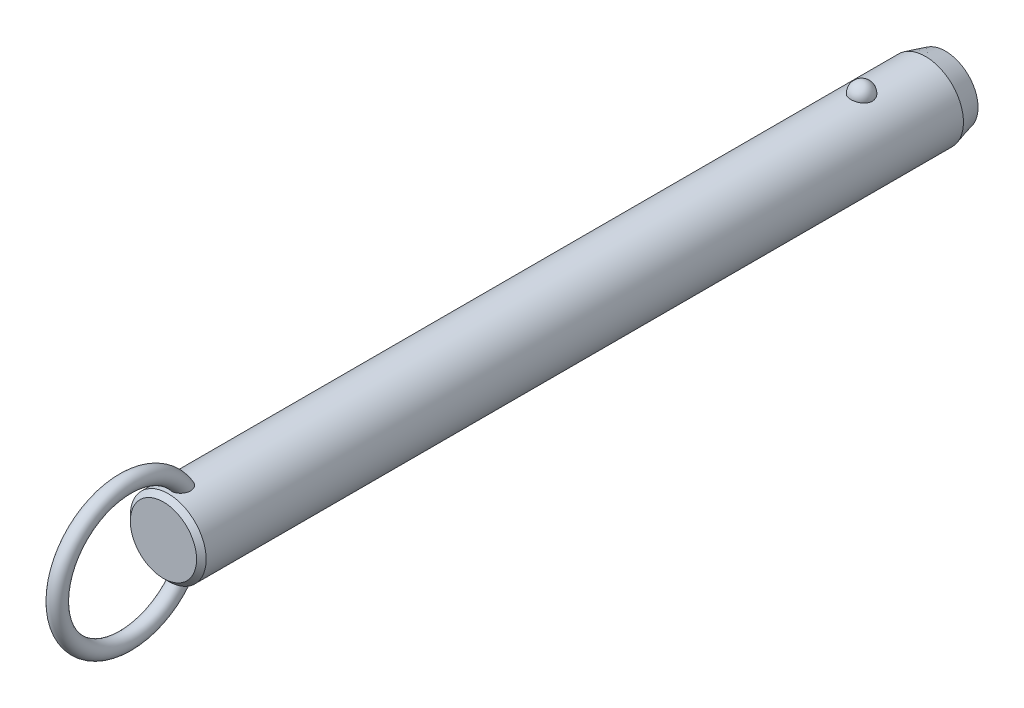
SolidWorks part; units mm, degrees
ref_plane "Front Plane" through (0, 0, 0) normal (0, 0, 1) x (1, 0, 0)
ref_plane "Top Plane" through (0, 0, 0) normal (0, 1, 0) x (1, 0, 0)
ref_plane "Right Plane" through (0, 0, 0) normal (1, 0, 0) x (0, 0, -1)
sketch "Sketch2" plane through (0, 0, 0) normal (0, 0, 1) x (1, 0, 0)
  circle A0 centre (0, 0) radius 9.5
  point P3 (0, 9.5)
  dimension "D1" = 19
extrude "Boss-Extrude1" add sketch "Sketch2" along normal blind 162.6
sketch "Sketch3" plane through (0, 0, 0) normal (0, 0, -1) x (-1, 0, 0)
  circle A0 centre (0, 0) radius 9.5
  dimension "D1" = 19
extrude "Boss-Extrude2" add sketch "Sketch3" along normal blind 23.7
chamfer "Chamfer1" distance 5 angle 15 1 edges at (-9.5, 0, -23.7)
sketch "Sketch12" plane through (0, 0, 0) normal (1, 0, 0) x (0, 0, -1)
  line L0 (-162.6, 9.5) -> (-162.6, -9.5) construction
  point P0 (-162.6, 0)
sketch "Sketch13" plane through (0, 0, 0) normal (1, 0, 0) x (0, 0, -1)
  circle A0 centre (-181.65, 0) radius 19.05
  point P2 (-162.6, 0)
  dimension "D1" = 38.1
sketch "Sketch14" plane through (0, 0, 0) normal (0, 1, 0) x (1, 0, 0)
  circle A0 centre (0, -164.6) radius 2
  point P2 (0, -162.6)
  dimension "D1" = 4
sweep "Sweep1" add profiles "Sketch14" path "Sketch13"
sketch "Sketch15" plane through (0, 0, 162.6) normal (0, 0, 1) x (1, 0, 0)
  circle A0 centre (0, 0) radius 9.5
  dimension "D1" = 19
extrude "Boss-Extrude3" add sketch "Sketch15" along normal blind 9.52
chamfer "Chamfer2" distance 1.2 angle 45 1 edges at (9.5, 0, 172.12)
sketch "Sketch18" plane through (0, 0, 0) normal (1, 0, 0) x (0, 0, -1)
  line L0 (18.7, 9.5) -> (-165.1378, 9.5) construction
  line L1 (2.7, 12.2) -> (2.7, 6.8)
  line L2 (-165.1378, -9.5) -> (18.7, -9.5) construction
  arc A0 (2.7, 12.2) -> (2.7, 6.8) centre (2.7, 9.5) ccw
  point P4 (0, 9.5)
  dimension "D1" = 21.7
revolve "Revolve1" add sketch "Sketch18" angle 360 about L1
